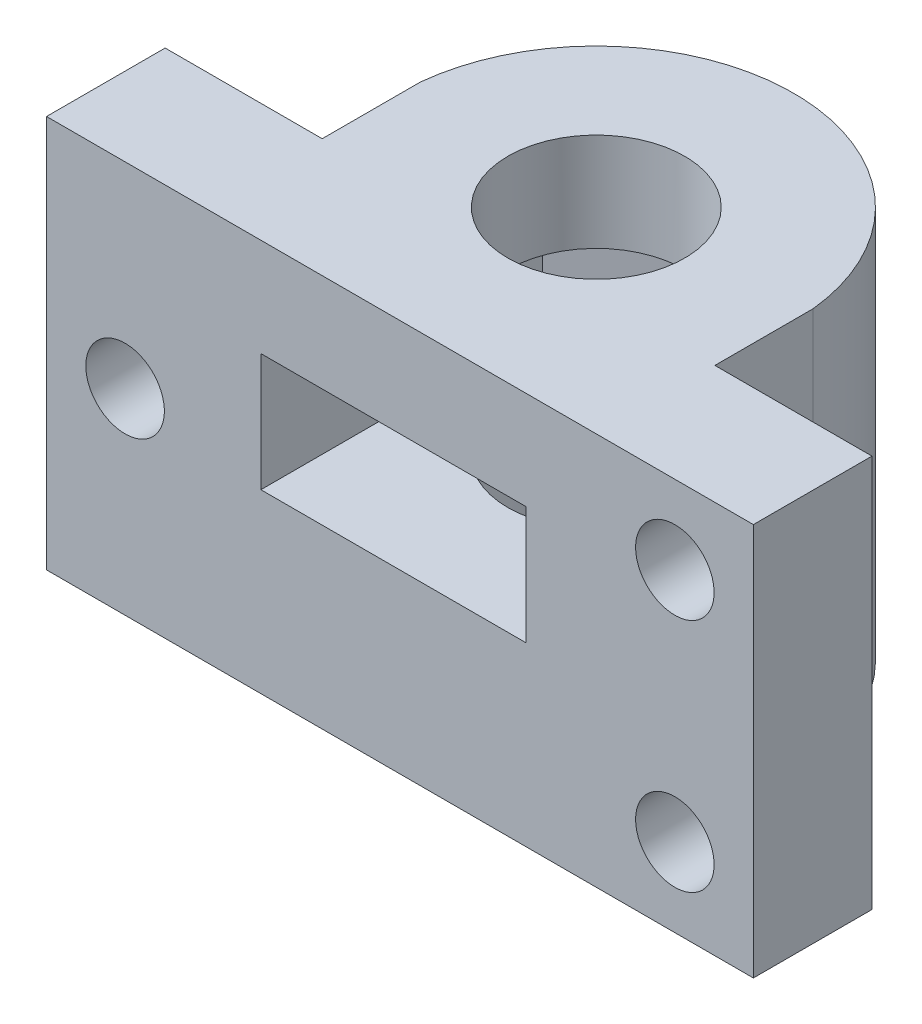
SolidWorks part; units mm, degrees
ref_plane "Front Plane" through (0, 0, 0) normal (0, 0, 1) x (1, 0, 0)
ref_plane "Top Plane" through (0, 0, 0) normal (0, 1, 0) x (1, 0, 0)
ref_plane "Right Plane" through (0, 0, 0) normal (1, 0, 0) x (0, 0, -1)
sketch "Sketch1" plane through (0, 0, 0) normal (0, 1, 0) x (1, 0, 0)
  line L0 (0, 0) -> (20, 0)
  line L1 (0, 11.04) -> (0, 6.04)
  line L2 (20, 6.04) -> (20, 11.04)
  line L3 (0, 0) -> (-8, 0)
  line L4 (-8, 0) -> (-8, 6.04)
  line L5 (-8, 6.04) -> (0, 6.04)
  line L6 (20, 0) -> (28, 0)
  line L7 (28, 0) -> (28, 6.04)
  line L8 (28, 6.04) -> (20, 6.04)
  circle A0 centre (10, 10) radius 4.5
  arc A1 (0, 11.04) -> (20, 11.04) centre (10, 10) cw
  dimension "D1" = 10
  dimension "D2" = 5
  dimension "D3" = 9
  dimension "D4" = 5
extrude "Boss-Extrude1" add sketch "Sketch1" along normal blind 20
ref_plane "Plane1" through (0, 15, 0) normal (0, 1, 0) x (1, 0, 0)
sketch "Sketch4" plane through (0, 15, 0) normal (0, 1, 0) x (1, 0, 0)
  line L0 (10, 10) -> (10, -3.0938) construction
  line L2 (10, 2.4944) -> (16.5, 6.2472)
  line L3 (16.5, 6.2472) -> (16.5, 13.7528)
  line L4 (16.5, 13.7528) -> (10, 17.5056)
  line L5 (10, 17.5056) -> (3.5, 13.7528)
  line L6 (3.5, 13.7528) -> (3.5, 6.2472)
  line L7 (3.5, 6.2472) -> (10, 2.4944)
  circle A0 centre (10, 10) radius 6.5 construction
extrude "Cut-Extrude2" cut sketch "Sketch4" against normal blind 6
sketch "Sketch9" plane through (0, 0, -6.04) normal (0, 0, -1) x (-1, 0, 0)
  line L0 (-28, 20) -> (-28, 0) construction
  line L1 (-28, 0) -> (-20, 0) construction
  line L2 (-28, 20) -> (-20, 20) construction
  line L3 (8, 20) -> (8, 0) construction
  line L4 (0, 20) -> (8, 20) construction
  circle A0 centre (-24, 4) radius 2
  circle A1 centre (-24, 16) radius 2
  circle A2 centre (4, 10) radius 2
  dimension "D1" = 4
  dimension "D5" = 4
  dimension "D2" = 4
  dimension "D3" = 4
  dimension "D4" = 4
  dimension "D6" = 10
extrude "Cut-Extrude4" cut sketch "Sketch9" against normal through all
ref_plane "Plane7" through (0, 0, -6.2472) normal (0, 0, -1) x (-1, 0, 0)
sketch "Sketch10" plane through (0, 0, -6.2472) normal (0, 0, -1) x (-1, 0, 0)
  line L1 (-2.9173, 8.9958) -> (-16.4104, 8.9958)
  line L2 (-2.9173, 8.9958) -> (-2.9173, 15.0012)
  line L3 (-2.9173, 15.0012) -> (-16.4104, 15.0012)
  line L4 (-16.4104, 8.9958) -> (-16.4104, 15.0012)
extrude "Cut-Extrude5" cut sketch "Sketch10" against normal blind 10
